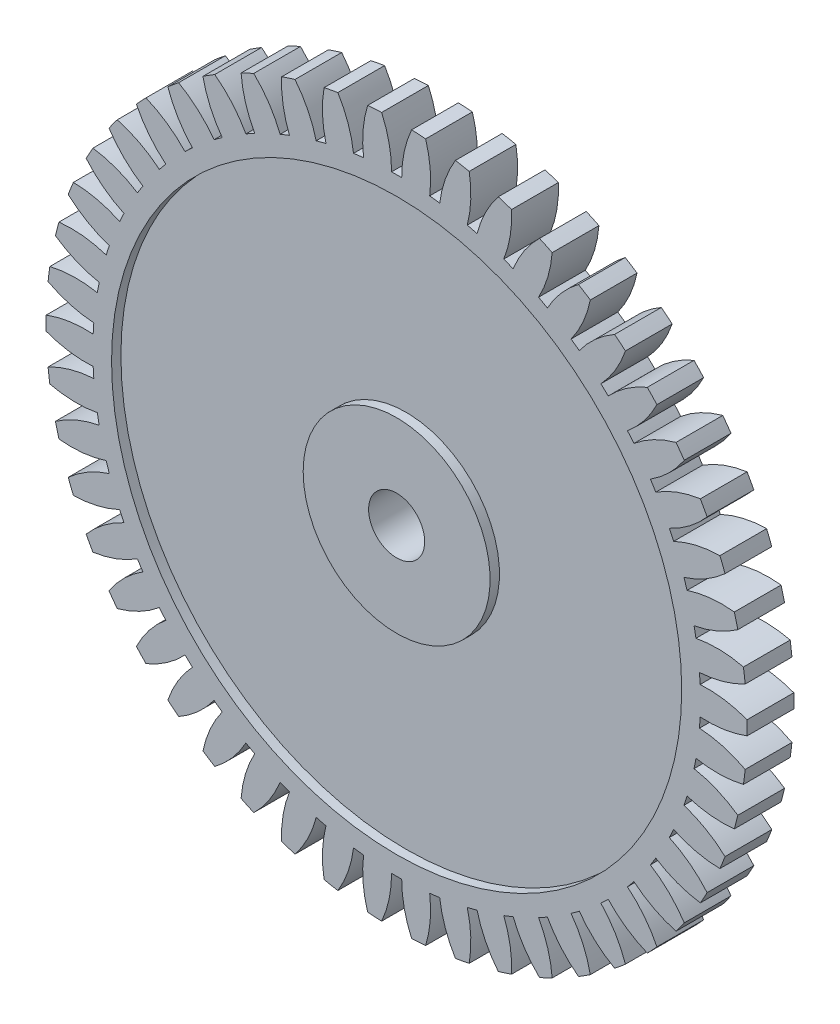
SolidWorks part; units mm, degrees
ref_plane "Front Plane" through (0, 0, 0) normal (0, 0, 1) x (1, 0, 0)
ref_plane "Top Plane" through (0, 0, 0) normal (0, 1, 0) x (1, 0, 0)
ref_plane "Right Plane" through (0, 0, 0) normal (1, 0, 0) x (0, 0, -1)
sketch "Sketch1" plane through (0, 0, 0) normal (0, 0, 1) x (1, 0, 0)
  circle A0 centre (0, 0) radius 6.5
  dimension "D1" = 13
extrude "Extrude1" add sketch "Sketch1" along normal mid plane 1
sketch "Sketch2" plane through (0, 0, 0.5) normal (0, 0, 1) x (1, 0, 0)
  line L0 (-7.5, 0) -> (-6.5, 0) construction
  arc A2 (-6.4931, 0.3) -> (-6.4931, -0.3) centre (0, 0) ccw
  arc A3 (-7.4985, -0.15) -> (-6.4931, -0.3) centre (-6.6497, 2.0949) ccw
  arc A4 (-7.4985, 0.15) -> (-7.4985, -0.15) centre (0, 0) ccw
  arc A5 (-6.4931, 0.3) -> (-7.4985, 0.15) centre (-6.6497, -2.0949) ccw
  circle A12 centre (0, 0) radius 6.5 construction
  point P7 (0, 0)
  dimension "D1" = 1
  dimension "D2" = 2.4
  dimension "D3" = 2.4
  dimension "D4" = 0.3
  dimension "D5" = 0.6
extrude "Extrude2" add sketch "Sketch2" against normal blind 1
pattern_circular "CirPattern1" count 50 over 360 about axis through (0, 0, 0) along (0, 0, 1) of "Extrude2"
sketch "Sketch3" plane through (0, 0, -0.5) normal (0, 0, -1) x (-1, 0, 0)
  circle A0 centre (0, 0) radius 2
  circle A1 centre (0, 0) radius 6.1
  dimension "D1" = 4
  dimension "D2" = 12.2
extrude "Cut-Extrude1" cut sketch "Sketch3" against normal blind 0.2
mirror "Mirror1" about plane through (0, 0, 0) normal (0, 0, 1) of "Cut-Extrude1"
sketch "Sketch4" plane through (0, 0, -0.5) normal (0, 0, -1) x (-1, 0, 0)
  line L0 (0, 1.7) -> (0, 0) construction
  arc A0 (-0.2, 1.2339) -> (-0.0737, 1.7985) centre (0.5142, 1.3705) cw
  arc A1 (0.0737, 1.7985) -> (-0.0737, 1.7985) centre (0, 0) ccw
  arc A3 (-0.2, 1.2339) -> (0.2, 1.2339) centre (0, 0) ccw
  arc A6 (0.2, 1.2339) -> (0.0737, 1.7985) centre (-0.5142, 1.3705) ccw
  dimension "D1" = 1.25
  dimension "D2" = 1.8
  dimension "D3" = 0.2
  dimension "D4" = 0.7272
  dimension "D5" = 0.1473
extrude "Extrude3" add sketch "Sketch4" along normal blind 1.5
pattern_circular "CirPattern2" count 14 over 360 about axis through (0, 0, 0) along (0, 0, 1) of "Extrude3"
sketch "Sketch5" plane through (0, 0, -2) normal (0, 0, -1) x (-1, 0, 0)
  circle A0 centre (0, 0) radius 0.6
  dimension "D1" = 1.2
extrude "Cut-Extrude2" cut sketch "Sketch5" against normal up to surface (2.5 mm away)
